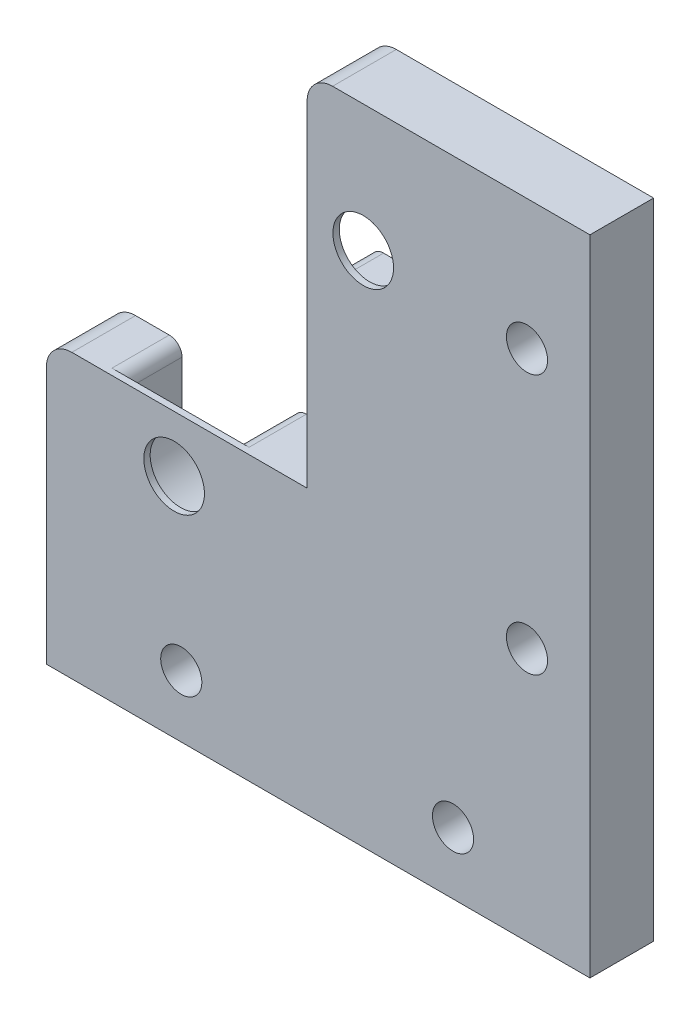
SolidWorks part; units mm, degrees
ref_plane "Front Plane" through (0, 0, 0) normal (0, 0, 1) x (1, 0, 0)
ref_plane "Top Plane" through (0, 0, 0) normal (0, 1, 0) x (1, 0, 0)
ref_plane "Right Plane" through (0, 0, 0) normal (1, 0, 0) x (0, 0, -1)
sketch "Sketch1" plane through (0, 0, 0) normal (0, 0, 1) x (1, 0, 0)
  line L6 (-810.8141, 612.9135) -> (-817.6657, 612.9135)
  line L7 (-810.8141, 612.9135) -> (-779.225, 612.9135)
  line L8 (-493.7649, 564.4955) -> (-493.7649, 1167.7963)
  line L9 (-493.7649, 1167.7963) -> (-817.6657, 1167.7963)
  line L10 (-817.6657, 1167.7963) -> (-817.6657, 564.4955)
  line L11 (-817.6657, 564.4955) -> (-493.7649, 564.4955)
  line L12 (-779.225, 612.9135) -> (-779.225, 571.3471)
  line L13 (-779.225, 571.3471) -> (-779.225, 564.4955)
  circle A2 centre (-798.6157, 583.5455) radius 2.667
extrude "Boss-Extrude1" add sketch "Sketch1" along normal blind 6.35 contours L13 L12 L7 L6 L10 L11 A2
sketch "Sketch2" plane through (0, 0, 6.35) normal (0, 0, 1) x (1, 0, 0)
  line L0 (-779.225, 564.4955) -> (-779.225, 555.0975)
  line L1 (-817.6657, 612.9135) -> (-827.0637, 612.9135)
  line L3 (-827.0637, 612.9135) -> (-779.225, 612.9135)
  line L4 (-779.225, 564.4955) -> (-779.225, 612.9135)
  line L5 (-779.225, 612.9135) -> (-817.6657, 612.9135)
  line L6 (-817.6657, 612.9135) -> (-817.6657, 564.4955)
  line L7 (-817.6657, 564.4955) -> (-779.225, 564.4955)
  line L8 (-779.225, 564.4955) -> (-779.225, 612.9135)
  line L9 (-779.225, 612.9135) -> (-817.6657, 612.9135)
  line L10 (-817.6657, 612.9135) -> (-817.6657, 564.4955)
  line L11 (-817.6657, 564.4955) -> (-779.225, 564.4955)
  line L12 (-827.0637, 612.9135) -> (-827.0637, 555.0975)
  line L13 (-827.0637, 555.0975) -> (-779.225, 555.0975)
  line L14 (-779.225, 612.9135) -> (-779.225, 555.0975)
  dimension "D2" = 9.398
  dimension "D1" = 0
extrude "Boss-Extrude2" add sketch "Sketch2" against normal up to vertex (996.0964 mm away) contours L12 L13 L0 L1 M15 M14
sketch "Sketch6" plane through (0, 0, 0) normal (0, 0, -1) x (-1, 0, 0)
  line L4 (779.225, 612.9135) -> (779.225, 555.0975)
  line L5 (779.225, 555.0975) -> (827.0637, 555.0975)
  line L6 (827.0637, 555.0975) -> (827.0637, 612.9135)
  line L7 (827.0637, 612.9135) -> (779.225, 612.9135)
  line L8 (779.225, 612.9135) -> (779.225, 555.0975)
  line L9 (779.225, 555.0975) -> (827.0637, 555.0975)
  line L10 (827.0637, 555.0975) -> (827.0637, 612.9135)
  line L11 (827.0637, 612.9135) -> (779.225, 612.9135)
  line L12 (804.9657, 562.1587) -> (817.4117, 562.1587)
  line L14 (819.1897, 562.1587) -> (820.0025, 562.1587)
  line L15 (820.0025, 562.1587) -> (820.0025, 612.9135)
  line L20 (817.4117, 562.1587) -> (819.1897, 562.1587)
  line L21 (804.9657, 562.1587) -> (779.225, 562.1587)
  dimension "D1" = 0
extrude "Boss-Extrude4" add sketch "Sketch6" along normal up to surface (78.0796 mm away) contours L12 L21 L8 L15 L14 L20 M11 M12 M13
sketch "Sketch7" plane through (0, 0, -78.0796) normal (0, 0, -1) x (-1, 0, 0)
  line L6 (805.2197, 576.9415) -> (805.2197, 612.9135)
  line L7 (779.225, 576.9415) -> (804.6609, 576.9415)
  line L8 (820.0025, 612.9135) -> (827.0637, 612.9135)
  line L9 (827.0637, 612.9135) -> (827.0637, 555.0975)
  line L10 (827.0637, 555.0975) -> (779.225, 555.0975)
  line L11 (779.225, 555.0975) -> (779.225, 562.1587)
  line L12 (779.225, 562.1587) -> (779.225, 576.9415)
  line L13 (820.0025, 612.9135) -> (805.2197, 612.9135)
  line L14 (804.6609, 576.9415) -> (805.2197, 576.9415)
  circle A2 centre (791.9609, 571.3471) radius 2.3812
  circle A3 centre (810.8141, 600.2587) radius 2.3812
sketch "Sketch8" plane through (0, 0, -78.0796) normal (0, 0, -1) x (-1, 0, 0)
  line L9 (805.2197, 612.9135) -> (805.2197, 576.9415)
  line L10 (820.0025, 612.9135) -> (805.2197, 612.9135)
  line L11 (827.0637, 612.9135) -> (820.0025, 612.9135)
  line L12 (827.0637, 555.0975) -> (827.0637, 612.9135)
  line L13 (779.225, 555.0975) -> (827.0637, 555.0975)
  line L14 (779.225, 562.1587) -> (779.225, 555.0975)
  line L15 (779.225, 576.9415) -> (779.225, 562.1587)
  line L16 (804.6609, 576.9415) -> (779.225, 576.9415)
  line L17 (805.2197, 576.9415) -> (804.6609, 576.9415)
  line L18 (805.2197, 612.9135) -> (805.2197, 576.9415)
  line L19 (820.0025, 612.9135) -> (805.2197, 612.9135)
  line L20 (827.0637, 612.9135) -> (820.0025, 612.9135)
  line L21 (827.0637, 555.0975) -> (827.0637, 612.9135)
  line L22 (779.225, 555.0975) -> (827.0637, 555.0975)
  line L23 (779.225, 562.1587) -> (779.225, 555.0975)
  line L24 (779.225, 576.9415) -> (779.225, 562.1587)
  line L25 (804.6609, 576.9415) -> (779.225, 576.9415)
  line L26 (805.2197, 576.9415) -> (804.6609, 576.9415)
  circle A1 centre (810.8141, 600.2587) radius 2.3813
  circle A2 centre (810.8141, 600.2587) radius 2.3812
  circle A3 centre (791.9609, 571.3471) radius 2.3813
  circle A4 centre (791.9609, 571.3471) radius 2.3812
  dimension "D1" = 0
  dimension "D2" = 0
  dimension "D3" = 0
extrude "Boss-Extrude6" add sketch "Sketch8" along normal blind 2.54
other "Cavity1"
other "5 SIDED ENCLOSURE 3 INCH.stp<1>@Assem11"
sketch "Sketch9" plane through (0, 612.9135, 0) normal (0, 1, 0) x (1, 0, 0)
  line L0 (-820.7645, 76.454) -> (-820.8153, 73.0504)
  line L1 (-820.8153, 3.1496) -> (-820.8153, 0)
  line L2 (-820.8153, 0) -> (-820.0025, 0)
  line L3 (-820.0025, 76.454) -> (-820.0025, 78.0796)
  line L4 (-820.0025, 78.0796) -> (-820.0025, 0)
  line L5 (-820.8153, 0) -> (-821.0693, 0)
  line L6 (-821.0693, 0) -> (-821.0693, 78.0796)
  line L7 (-821.0693, 78.0796) -> (-820.7645, 78.0796)
  line L12 (-820.7645, 76.454) -> (-820.7645, 78.0796)
  line L13 (-820.7645, 78.0796) -> (-805.2197, 78.0796)
  line L14 (-805.2197, 78.0796) -> (-805.2197, 80.6196)
  line L15 (-805.2197, 80.6196) -> (-827.0637, 80.6196)
  line L16 (-827.0637, 80.6196) -> (-827.0637, -6.35)
  line L17 (-827.0637, -6.35) -> (-779.225, -6.35)
  line L18 (-779.225, -6.35) -> (-779.225, 0)
  line L19 (-779.225, 0) -> (-820.0025, 0)
  line L20 (-820.0025, 0) -> (-820.0025, 1.0379)
  line L21 (-820.8153, 3.1496) -> (-820.8153, 73.0504)
  line L22 (-820.0025, 75.1621) -> (-820.0025, 76.454)
  line L23 (-820.0025, 76.454) -> (-820.7645, 76.454)
  line L24 (-820.7645, 76.454) -> (-820.7645, 78.0796)
  line L25 (-820.7645, 78.0796) -> (-805.2197, 78.0796)
  line L26 (-805.2197, 78.0796) -> (-805.2197, 80.6196)
  line L27 (-805.2197, 80.6196) -> (-827.0637, 80.6196)
  line L28 (-827.0637, 80.6196) -> (-827.0637, -6.35)
  line L29 (-827.0637, -6.35) -> (-779.225, -6.35)
  line L30 (-779.225, -6.35) -> (-779.225, 0)
  line L31 (-779.225, 0) -> (-820.0025, 0)
  line L32 (-820.0025, 0) -> (-820.0025, 1.0379)
  line L33 (-820.8153, 3.1496) -> (-820.8153, 73.0504)
  line L34 (-820.0025, 75.1621) -> (-820.0025, 76.454)
  line L35 (-820.0025, 76.454) -> (-820.7645, 76.454)
  arc A2 (-820.8153, 3.1496) -> (-820.0025, 1.0379) centre (-817.6657, 3.1496) ccw
  arc A3 (-820.0025, 75.1621) -> (-820.8153, 73.0504) centre (-817.6657, 73.0504) ccw
  arc A4 (-820.8153, 3.1496) -> (-820.0025, 1.0379) centre (-817.6657, 3.1496) ccw
  arc A5 (-820.0025, 75.1621) -> (-820.8153, 73.0504) centre (-817.6657, 73.0504) ccw
  dimension "D2" = 0.254
  dimension "D1" = 0
extrude "Cut-Extrude3" cut sketch "Sketch9" against normal up to surface (50.7548 mm away) contours L0 M28 M26 M27 | L7 L6 L5 L1 L0 M25 M26 M15 | L1 L2 M23 M24
sketch "Sketch10" plane through (-779.225, 0, 0) normal (1, 0, 0) x (0, 0, -1)
  line L0 (78.0796, 561.3459) -> (78.0796, 561.0919)
  line L1 (78.0796, 561.0919) -> (0, 561.0919)
  line L2 (0, 561.0919) -> (0, 562.1587)
  line L4 (24.4475, 562.1587) -> (24.4475, 561.3459) construction
  line L5 (24.4475, 562.1587) -> (24.4475, 561.3459)
  line L6 (0, 562.4127) -> (0, 562.1587)
  line L7 (0, 562.4127) -> (78.0796, 562.4127)
  line L8 (76.1963, 562.4127) -> (76.1963, 562.1587)
  line L9 (78.0796, 562.4127) -> (76.1963, 562.4127)
  line L10 (78.0796, 562.4127) -> (78.0796, 565.7277)
  line L11 (78.0796, 565.7277) -> (76.1963, 565.7277)
  line L12 (78.0796, 576.9415) -> (78.0796, 561.3459)
  line L13 (78.0796, 561.3459) -> (76.454, 561.3459)
  line L14 (76.454, 561.3459) -> (76.454, 562.1587)
  line L15 (76.454, 562.1587) -> (75.1621, 562.1587)
  line L16 (73.0504, 561.3459) -> (3.1496, 561.3459)
  line L17 (1.0379, 562.1587) -> (0, 562.1587)
  line L18 (0, 562.1587) -> (0, 612.9135)
  line L19 (0, 612.9135) -> (-6.35, 612.9135)
  line L20 (-6.35, 612.9135) -> (-6.35, 555.0975)
  line L21 (-6.35, 555.0975) -> (80.6196, 555.0975)
  line L22 (80.6196, 555.0975) -> (80.6196, 576.9415)
  line L23 (80.6196, 576.9415) -> (78.0796, 576.9415)
  line L24 (78.0796, 576.9415) -> (78.0796, 561.3459)
  line L25 (78.0796, 561.3459) -> (76.454, 561.3459)
  line L26 (76.454, 561.3459) -> (76.454, 562.1587)
  line L27 (76.454, 562.1587) -> (75.1621, 562.1587)
  line L28 (73.0504, 561.3459) -> (3.1496, 561.3459)
  line L29 (1.0379, 562.1587) -> (0, 562.1587)
  line L30 (0, 562.1587) -> (0, 612.9135)
  line L31 (0, 612.9135) -> (-6.35, 612.9135)
  line L32 (-6.35, 612.9135) -> (-6.35, 555.0975)
  line L33 (-6.35, 555.0975) -> (80.6196, 555.0975)
  line L34 (80.6196, 555.0975) -> (80.6196, 576.9415)
  line L35 (80.6196, 576.9415) -> (78.0796, 576.9415)
  line L36 (76.1963, 562.4127) -> (76.1963, 565.7277)
  line L37 (0, 561.0919) -> (3.4229, 561.0919)
  line L38 (0, 561.0919) -> (0, 564.0863)
  line L39 (0, 564.0863) -> (3.4229, 564.0863)
  line L40 (3.4229, 561.0919) -> (3.4229, 564.0863)
  arc A2 (73.0504, 561.3459) -> (75.1621, 562.1587) centre (73.0504, 564.4955) ccw
  arc A3 (1.0379, 562.1587) -> (3.1496, 561.3459) centre (3.1496, 564.4955) ccw
  arc A4 (73.0504, 561.3459) -> (75.1621, 562.1587) centre (73.0504, 564.4955) ccw
  arc A5 (1.0379, 562.1587) -> (3.1496, 561.3459) centre (3.1496, 564.4955) ccw
  dimension "D2" = 0.254
  dimension "D3" = 0.254
  dimension "D1" = 0
extrude "Cut-Extrude5" cut sketch "Sketch10" against normal up to surface (41.8444 mm away)
sketch "Sketch12" plane through (0, 0, -80.6196) normal (0, 0, -1) x (-1, 0, 0)
  line L6 (827.0637, 612.9135) -> (805.2197, 612.9135)
  line L7 (805.2197, 612.9135) -> (805.2197, 576.9415)
  line L8 (805.2197, 576.9415) -> (779.225, 576.9415)
  line L9 (779.225, 576.9415) -> (779.225, 555.0975)
  line L10 (779.225, 555.0975) -> (827.0637, 555.0975)
  line L11 (827.0637, 555.0975) -> (827.0637, 612.9135)
  line L12 (827.0637, 612.9135) -> (805.2197, 612.9135)
  line L13 (805.2197, 612.9135) -> (805.2197, 576.9415)
  line L14 (805.2197, 576.9415) -> (779.225, 576.9415)
  line L15 (779.225, 576.9415) -> (779.225, 555.0975)
  line L16 (779.225, 555.0975) -> (827.0637, 555.0975)
  line L17 (827.0637, 555.0975) -> (827.0637, 612.9135)
  circle A1 centre (791.9609, 571.3471) radius 2.3813
  circle A2 centre (791.9609, 571.3471) radius 2.3812
  circle A3 centre (810.8141, 600.2587) radius 2.3813
  circle A4 centre (810.8141, 600.2587) radius 2.3812
  dimension "D1" = 0
  dimension "D2" = 0
  dimension "D3" = 0
extrude "Boss-Extrude7" add sketch "Sketch12" along normal blind 3.81
sketch "Sketch13" plane through (0, 0, -84.4296) normal (0, 0, -1) x (-1, 0, 0)
  line L0 (797.5235, 571.3471) -> (797.5235, 576.9415)
  line L1 (805.2197, 576.9415) -> (779.225, 576.9415) construction
  line L2 (786.3983, 571.3471) -> (786.3983, 576.9415)
  line L3 (810.8141, 594.6961) -> (805.2197, 594.6961)
  line L4 (805.2197, 612.9135) -> (805.2197, 576.9415) construction
  line L5 (810.8141, 605.8213) -> (805.2197, 605.8213)
  line L12 (827.0637, 612.9135) -> (805.2197, 612.9135)
  line L13 (805.2197, 612.9135) -> (805.2197, 576.9415)
  line L14 (805.2197, 576.9415) -> (779.225, 576.9415)
  line L15 (779.225, 576.9415) -> (779.225, 555.0975)
  line L16 (779.225, 555.0975) -> (827.0637, 555.0975)
  line L17 (827.0637, 555.0975) -> (827.0637, 612.9135)
  line L18 (827.0637, 612.9135) -> (805.2197, 612.9135)
  line L19 (805.2197, 612.9135) -> (805.2197, 576.9415)
  line L20 (805.2197, 576.9415) -> (779.225, 576.9415)
  line L21 (779.225, 576.9415) -> (779.225, 555.0975)
  line L22 (779.225, 555.0975) -> (827.0637, 555.0975)
  line L23 (827.0637, 555.0975) -> (827.0637, 612.9135)
  circle A2 centre (810.8141, 600.2587) radius 3.0226
  circle A3 centre (791.9609, 571.3471) radius 3.0226
  circle A4 centre (791.9609, 571.3471) radius 5.5626
  circle A5 centre (810.8141, 600.2587) radius 5.5626
  dimension "D1" = 2.54
  dimension "D2" = 0
extrude "Cut-Extrude7" cut sketch "Sketch13" against normal blind 5.715 contours M16 | A5 A2 | A5 L5 L3 M7 | M3 | A3 M3 | A4 A3 | A4 L0 L2 M9
fillet "Fillet3" radius 1.27 4 edges at (-805.2197, 605.8213, -81.5721) (-805.2197, 594.6961, -81.5721) (-797.5235, 576.9415, -81.5721) (-786.3983, 576.9415, -81.5721)
sketch "Sketch14" plane through (0, 0, 6.35) normal (0, 0, 1) x (1, 0, 0)
  line L4 (-779.225, 612.9135) -> (-827.0637, 612.9135)
  line L5 (-827.0637, 612.9135) -> (-827.0637, 555.0975)
  line L6 (-827.0637, 555.0975) -> (-779.225, 555.0975)
  line L7 (-779.225, 555.0975) -> (-779.225, 612.9135)
  line L8 (-779.225, 612.9135) -> (-827.0637, 612.9135)
  line L9 (-827.0637, 612.9135) -> (-827.0637, 555.0975)
  line L10 (-827.0637, 555.0975) -> (-779.225, 555.0975)
  line L11 (-779.225, 555.0975) -> (-779.225, 612.9135)
  circle A1 centre (-798.6157, 583.5455) radius 12.7
  circle A2 centre (-798.6157, 583.5455) radius 12.954
  dimension "D1" = 0
  dimension "D2" = 0.254
extrude "Cut-Extrude8" cut sketch "Sketch14" against normal blind 5.715 contours A2 A1 | A1 M9 | M9
fillet "Fillet4" radius 2.54 3 edges at (-779.225, 576.9415, -81.2546) (-805.2197, 612.9135, -81.2546) (-779.225, 612.9135, 3.175)
sketch "Sketch15" plane through (0, 0, 6.35) normal (0, 0, 1) x (1, 0, 0)
  line L0 (-779.225, 555.0975) -> (-779.225, 610.3735) construction
  line L1 (-781.765, 612.9135) -> (-827.0637, 612.9135) construction
  line L2 (-827.0637, 612.9135) -> (-827.0637, 555.0975) construction
  line L3 (-827.0637, 555.0975) -> (-779.225, 555.0975) construction
  line L4 (-779.225, 555.0975) -> (-779.225, 610.3735)
  line L5 (-781.765, 612.9135) -> (-827.0637, 612.9135)
  line L6 (-827.0637, 612.9135) -> (-827.0637, 555.0975)
  line L7 (-827.0637, 555.0975) -> (-779.225, 555.0975)
  arc A1 (-779.225, 610.3735) -> (-781.765, 612.9135) centre (-781.765, 610.3735) ccw construction
  arc A3 (-779.225, 610.3735) -> (-781.765, 612.9135) centre (-781.765, 610.3735) ccw
extrude "Cut-Extrude10" cut sketch "Sketch15" against normal up to surface (84.4296 mm away)
ref_plane "Plane1" through (-776.685, 0, 0) normal (1, 0, 0) x (0, 0, -1)
mirror "Mirror1" about plane through (-776.685, 0, 0) normal (1, 0, 0)
sketch "Sketch16" plane through (0, 0, -78.0796) normal (0, 0, 1) x (1, 0, 0)
  line L6 (-807.7597, 612.9135) -> (-827.0637, 612.9135)
  line L7 (-827.0637, 612.9135) -> (-827.0637, 555.0975)
  line L8 (-827.0637, 555.0975) -> (-779.225, 555.0975)
  line L9 (-779.225, 555.0975) -> (-779.225, 574.4015)
  line L10 (-781.765, 576.9415) -> (-805.2197, 576.9415)
  line L11 (-805.2197, 576.9415) -> (-805.2197, 610.3735)
  line L12 (-807.7597, 612.9135) -> (-827.0637, 612.9135)
  line L13 (-827.0637, 612.9135) -> (-827.0637, 555.0975)
  line L14 (-827.0637, 555.0975) -> (-779.225, 555.0975)
  line L15 (-779.225, 555.0975) -> (-779.225, 574.4015)
  line L16 (-781.765, 576.9415) -> (-805.2197, 576.9415)
  line L17 (-805.2197, 576.9415) -> (-805.2197, 610.3735)
  arc A2 (-779.225, 574.4015) -> (-781.765, 576.9415) centre (-781.765, 574.4015) ccw
  arc A3 (-805.2197, 610.3735) -> (-807.7597, 612.9135) centre (-807.7597, 610.3735) ccw
  arc A4 (-779.225, 574.4015) -> (-781.765, 576.9415) centre (-781.765, 574.4015) ccw
  arc A5 (-805.2197, 610.3735) -> (-807.7597, 612.9135) centre (-807.7597, 610.3735) ccw
  dimension "D1" = 0
extrude "Cut-Extrude11" cut sketch "Sketch16" against normal through all
sketch "Sketch17" plane through (0, 0, -84.4296) normal (0, 0, -1) x (-1, 0, 0)
  line L8 (719.9562, 555.0975) -> (726.3062, 555.0975)
  line L9 (726.3062, 555.0975) -> (726.3062, 612.9135)
  line L10 (726.3062, 612.9135) -> (719.9562, 612.9135)
  line L11 (719.9562, 612.9135) -> (719.9562, 555.0975)
  line L12 (771.605, 576.9415) -> (768.2416, 576.9415)
  line L13 (766.9716, 575.6715) -> (766.9716, 571.3471)
  line L14 (755.8464, 571.3471) -> (755.8464, 575.6715)
  line L15 (754.5764, 576.9415) -> (748.1502, 576.9415)
  line L16 (748.1502, 576.9415) -> (748.1502, 593.4261)
  line L17 (746.8802, 594.6961) -> (742.5559, 594.6961)
  line L18 (742.5559, 605.8213) -> (746.8802, 605.8213)
  line L19 (748.1502, 607.0913) -> (748.1502, 610.3735)
  line L20 (745.6102, 612.9135) -> (726.3062, 612.9135)
  line L21 (726.3062, 612.9135) -> (726.3062, 555.0975)
  line L22 (726.3062, 555.0975) -> (774.145, 555.0975)
  line L23 (774.145, 555.0975) -> (774.145, 574.4015)
  line L24 (771.605, 576.9415) -> (768.2416, 576.9415)
  line L25 (766.9716, 575.6715) -> (766.9716, 571.3471)
  line L26 (755.8464, 571.3471) -> (755.8464, 575.6715)
  line L27 (754.5764, 576.9415) -> (748.1502, 576.9415)
  line L28 (748.1502, 576.9415) -> (748.1502, 593.4261)
  line L29 (746.8802, 594.6961) -> (742.5559, 594.6961)
  line L30 (742.5559, 605.8213) -> (746.8802, 605.8213)
  line L31 (748.1502, 607.0913) -> (748.1502, 610.3735)
  line L32 (745.6102, 612.9135) -> (726.3062, 612.9135)
  line L33 (726.3062, 612.9135) -> (726.3062, 555.0975)
  line L34 (726.3062, 555.0975) -> (774.145, 555.0975)
  line L35 (774.145, 555.0975) -> (774.145, 574.4015)
  line L36 (774.145, 555.0975) -> (719.9562, 555.0975)
  line L37 (719.9562, 555.0975) -> (719.9562, 548.7475)
  line L38 (719.9562, 548.7475) -> (774.145, 548.7475)
  line L39 (774.145, 548.7475) -> (774.145, 555.0975)
  arc A8 (768.2416, 576.9415) -> (766.9716, 575.6715) centre (768.2416, 575.6715) ccw
  arc A9 (755.8464, 571.3471) -> (766.9716, 571.3471) centre (761.409, 571.3471) ccw
  arc A10 (755.8464, 575.6715) -> (754.5764, 576.9415) centre (754.5764, 575.6715) ccw
  arc A11 (748.1502, 593.4261) -> (746.8802, 594.6961) centre (746.8802, 593.4261) ccw
  arc A12 (742.5559, 605.8213) -> (742.5559, 594.6961) centre (742.5559, 600.2587) ccw
  arc A13 (746.8802, 605.8213) -> (748.1502, 607.0913) centre (746.8802, 607.0913) ccw
  arc A14 (748.1502, 610.3735) -> (745.6102, 612.9135) centre (745.6102, 610.3735) ccw
  arc A15 (774.145, 574.4015) -> (771.605, 576.9415) centre (771.605, 574.4015) ccw
  arc A16 (768.2416, 576.9415) -> (766.9716, 575.6715) centre (768.2416, 575.6715) ccw
  arc A17 (755.8464, 571.3471) -> (766.9716, 571.3471) centre (761.409, 571.3471) ccw
  arc A18 (755.8464, 575.6715) -> (754.5764, 576.9415) centre (754.5764, 575.6715) ccw
  arc A19 (748.1502, 593.4261) -> (746.8802, 594.6961) centre (746.8802, 593.4261) ccw
  arc A20 (742.5559, 605.8213) -> (742.5559, 594.6961) centre (742.5559, 600.2587) ccw
  arc A21 (746.8802, 605.8213) -> (748.1502, 607.0913) centre (746.8802, 607.0913) ccw
  arc A22 (748.1502, 610.3735) -> (745.6102, 612.9135) centre (745.6102, 610.3735) ccw
  arc A23 (774.145, 574.4015) -> (771.605, 576.9415) centre (771.605, 574.4015) ccw
  dimension "D1" = 0
extrude "Boss-Extrude8" add sketch "Sketch17" against normal up to surface (6.35 mm away) contours L38 L39 L8 L37 M38 | L10 L11 L8 M37
sketch "Sketch18" plane through (0, 0, -84.4296) normal (0, 0, -1) x (-1, 0, 0)
  line L1 (1060.2654, 561.3459) -> (735.1454, 561.3459)
  line L2 (897.7054, 561.3459) -> (897.7054, 508.8902)
  circle A4 centre (1034.7115, 554.9197) radius 2.05
  circle A5 centre (1061.8058, 554.9197) radius 2.05
  circle A6 centre (1069.1808, 574.0473) radius 2.05
  circle A7 centre (1069.1808, 599.9581) radius 2.05
  circle A8 centre (726.23, 599.9581) radius 2.05
  circle A9 centre (726.23, 574.0473) radius 2.05
  circle A10 centre (733.605, 554.9197) radius 2.05
  circle A11 centre (760.6994, 554.9197) radius 2.05
extrude "Cut-Extrude12" cut sketch "Sketch18" against normal through all contours A11 | A10 | A9 | A8
chamfer "Chamfer1" distance 1.27 angle 45 4 edges at (-762.7494, 554.9197, -84.4296) (-735.655, 554.9197, -84.4296) (-728.28, 574.0473, -84.4296) (-728.28, 599.9581, -84.4296)
